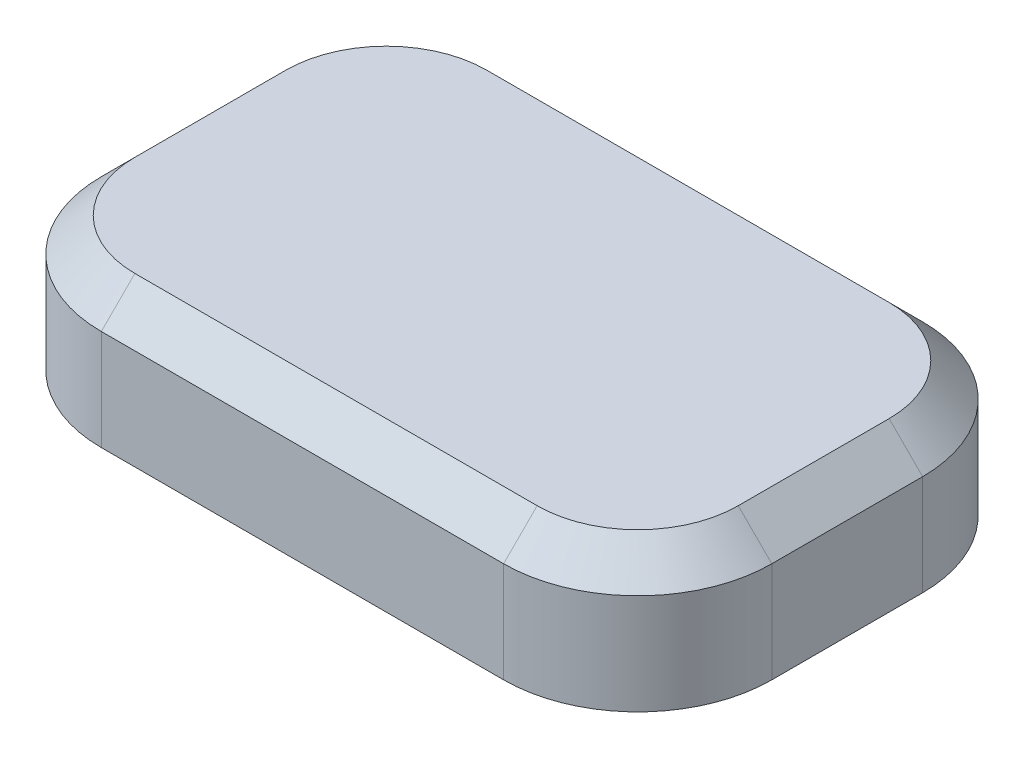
SolidWorks part; units mm, degrees
ref_plane "Front" through (0, 0, 0) normal (0, 0, 1) x (1, 0, 0)
ref_plane "Top" through (0, 0, 0) normal (0, 1, 0) x (1, 0, 0)
ref_plane "Right" through (0, 0, 0) normal (1, 0, 0) x (0, 0, -1)
sketch "Sketch1" plane through (0, 0, 0) normal (0, 1, 0) x (1, 0, 0)
  line L0 (100, -62.5) -> (-100, 62.5) construction
  line L1 (-100, 62.5) -> (100, 62.5)
  line L2 (-100, 62.5) -> (-100, -62.5)
  line L3 (-100, -62.5) -> (100, -62.5)
  line L4 (100, 62.5) -> (100, -62.5)
  dimension "D1" = 200
  dimension "D2" = 125
extrude "Extrude1" add sketch "Sketch1" along normal blind 40
fillet "Fillet1" radius 40 4 edges at (-100, 20, -62.5) (-100, 20, 62.5) (100, 20, -62.5) (100, 20, 62.5)
chamfer "Chamfer2" distance 10 angle 45 8 edges at (0, 40, -62.5) (-88.2843, 40, -50.7843) (88.2843, 40, -50.7843) (-100, 40, 0) (100, 40, 0) (-88.2843, 40, 50.7843) (88.2843, 40, 50.7843) (0, 40, 62.5)
